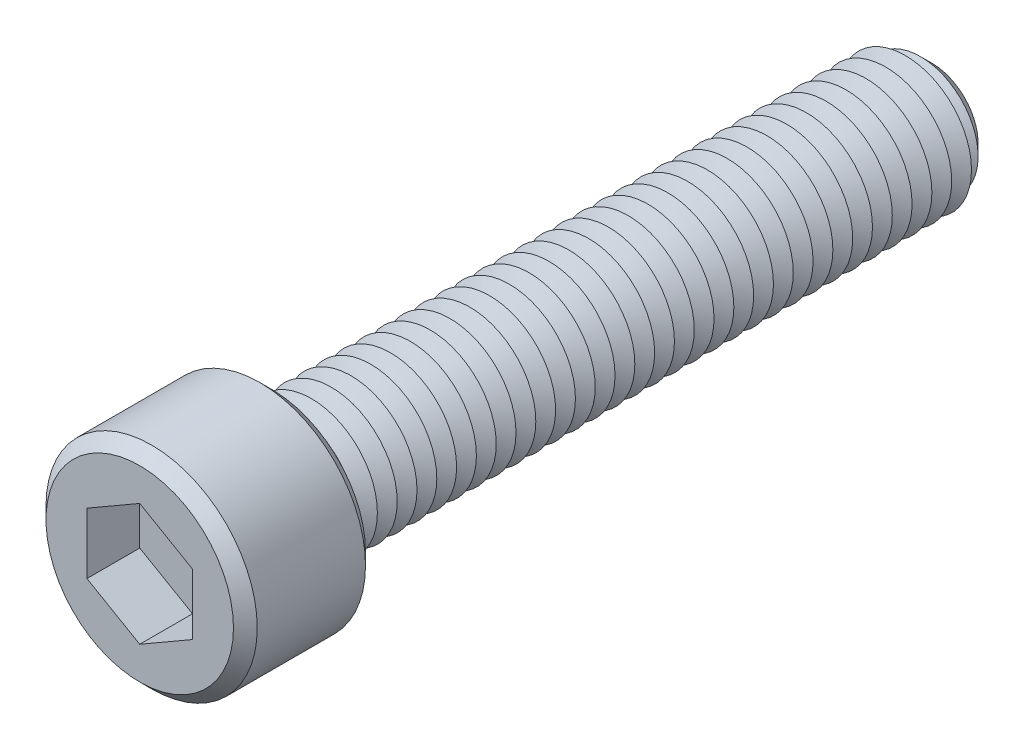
SolidWorks part; units mm, degrees
ref_plane "Front Plane" through (0, 0, 0) normal (0, 0, 1) x (1, 0, 0)
ref_plane "Top Plane" through (0, 0, 0) normal (0, 1, 0) x (1, 0, 0)
ref_plane "Right Plane" through (0, 0, 0) normal (1, 0, 0) x (0, 0, -1)
sketch "Sketch1" plane through (0, 0, 0) normal (0, 0, 1) x (1, 0, 0)
  circle A0 centre (0, 0) radius 8
  dimension "D1" = 16
extrude "Boss-Extrude1" add sketch "Sketch1" along normal blind 10
sketch "Sketch2" plane through (0, 0, 0) normal (0, 0, -1) x (-1, 0, 0)
  circle A0 centre (0, 0) radius 5
  dimension "D1" = 10
extrude "Boss-Extrude2" add sketch "Sketch2" along normal blind 50
chamfer "Chamfer1" distance 1.5 angle 45 1 edges at (-5, 0, -50)
sketch "Sketch3" plane through (0, 0, 0) normal (1, 0, 0) x (0, 0, -1)
  line L0 (-2.5121, 0) -> (4.5776, 0) construction
sketch "Sketch4" plane through (0, 0, 0) normal (1, 0, 0) x (0, 0, -1)
  line L0 (0, 5) -> (0.75, 3.701)
  line L1 (0.75, 3.701) -> (1.5, 5)
  line L2 (48.5, 5) -> (0, 5) construction
  line L3 (1.5, 5) -> (0, 5)
  dimension "D1" = 1.5
revolve "Cut-Revolve1" cut sketch "Sketch4" angle 360 about L0
pattern_linear "LPattern1" count 33 spacing 1.5 along (0, 0, -1) of "Cut-Revolve1"
sketch "Sketch5" plane through (0, 0, 10) normal (0, 0, 1) x (1, 0, 0)
  line L1 (0, 4.6188) -> (-4, 2.3094)
  line L2 (-4, 2.3094) -> (-4, -2.3094)
  line L3 (-4, -2.3094) -> (0, -4.6188)
  line L4 (0, -4.6188) -> (4, -2.3094)
  line L5 (4, -2.3094) -> (4, 2.3094)
  line L6 (4, 2.3094) -> (0, 4.6188)
  circle A0 centre (0, 0) radius 4 construction
  dimension "D1" = 8
extrude "Cut-Extrude1" cut sketch "Sketch5" against normal blind 4
sketch "Sketch6" plane through (0, 0, 6) normal (0, 0, 1) x (1, 0, 0)
  circle A0 centre (0, 0) radius 0.9
  dimension "D1" = 1.8
extrude "Cut-Extrude2" cut sketch "Sketch6" against normal up to surface (56 mm away)
chamfer "Chamfer2" distance 0.9 angle 45 2 edges at (8, 0, 0) (8, 0, 10)
